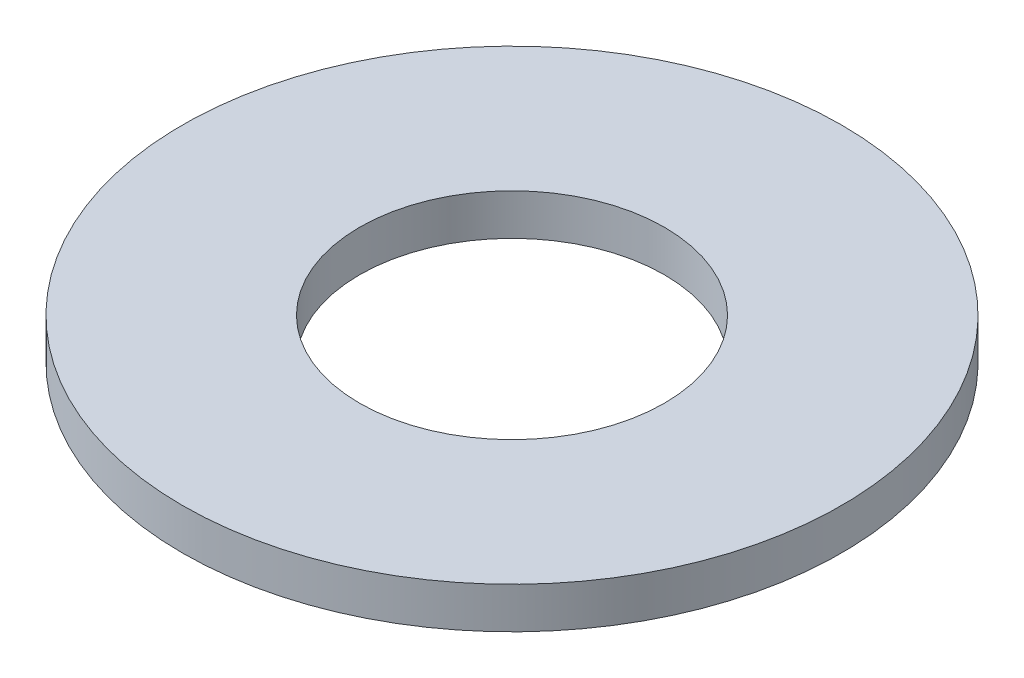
SolidWorks part; units mm, degrees
ref_plane "Front" through (0, 0, 0) normal (0, 0, 1) x (1, 0, 0)
ref_plane "Top" through (0, 0, 0) normal (0, 1, 0) x (1, 0, 0)
ref_plane "Right" through (0, 0, 0) normal (1, 0, 0) x (0, 0, -1)
sketch "Sketch1" plane through (0, 0, 0) normal (0, 1, 0) x (1, 0, 0)
  circle A0 centre (0, 0) radius 1.85
  circle A1 centre (0, 0) radius 4
extrude "Extrude1" add sketch "Sketch1" along normal blind 0.5
